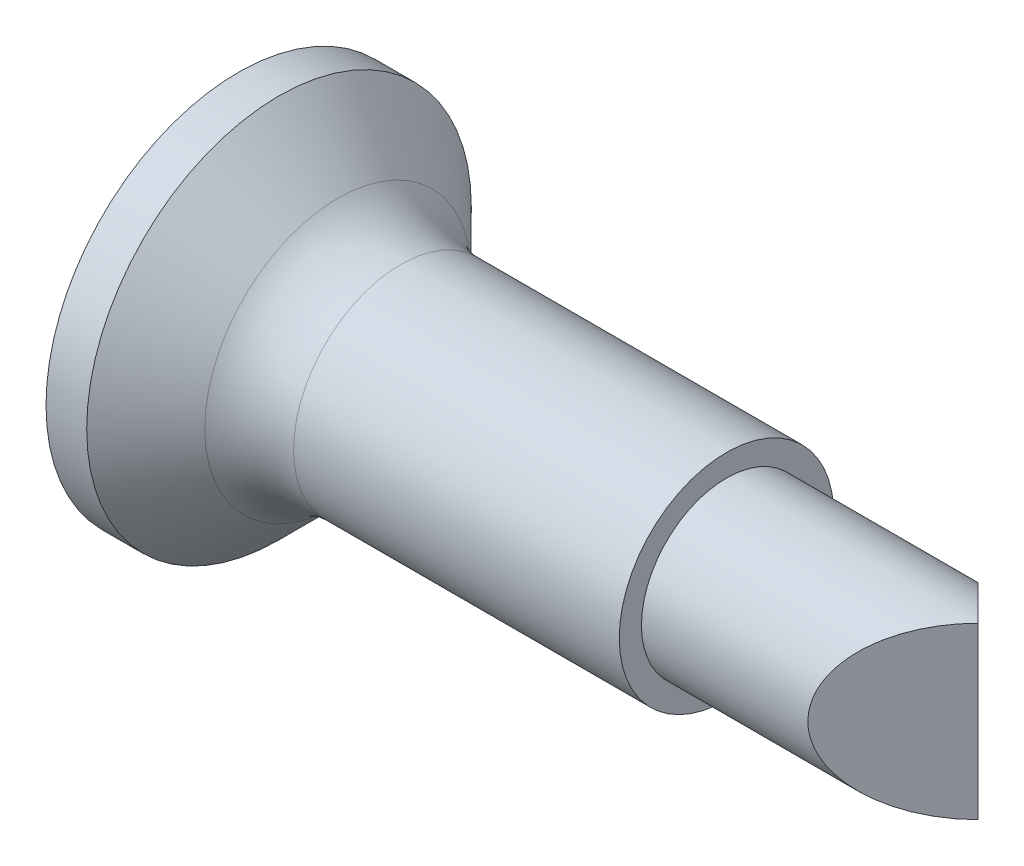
SolidWorks part; units mm, degrees
ref_plane "Front" through (0, 0, 0) normal (0, 0, 1) x (1, 0, 0)
ref_plane "Top" through (0, 0, 0) normal (0, 1, 0) x (1, 0, 0)
ref_plane "Right" through (0, 0, 0) normal (1, 0, 0) x (0, 0, -1)
sketch "Sketch1" plane through (0, 0, 0) normal (0, 0, 1) x (1, 0, 0)
  line L0 (-68.7142, 0) -> (93.1333, 0) construction
  line L1 (0.7, 2.6) -> (1.25, 2.6)
  line L2 (1.25, 2.6) -> (2.4, 1.45)
  line L3 (2.4, 1.45) -> (7.3, 1.45)
  line L4 (7.3, 1.45) -> (7.3, 1.15)
  line L5 (7.3, 1.15) -> (10.7, 1.15)
  line L6 (10.7, 1.15) -> (10.7, 0)
  line L7 (10.7, 0) -> (0, 0)
  line L8 (2.95, 2.6) -> (2.95, 0.6853) construction
  arc A0 (0.7, 2.6) -> (0, 0) centre (5.1786, 0) ccw
  dimension "d" = 2.9
  dimension "dp" = 2.3
  dimension "D4" = 45
  dimension "dk" = 5.2
  dimension "k" = 1.7
  dimension "f" = 0.7
  dimension "l" = 10
  dimension "lg" = 6.6
  dimension "a" = 1.1
revolve "Base" add sketch "Sketch1" angle 360 about L0
sketch "Sketch2" plane through (0, 0, 0) normal (0, 1, 0) x (1, 0, 0)
  line L0 (11.3362, 0) -> (14.3992, 0) construction
  line L2 (10.7, 0) -> (-4.3, 15)
  line L3 (-4.3, 15) -> (11.0466, 15)
  line L4 (11.0466, 15) -> (11.0466, -15)
  line L6 (-4.3, -15) -> (11.0466, -15)
  line L7 (10.7, 0) -> (-4.3, -15)
  line L8 (10.7, -1.15) -> (10.7, 1.15) construction
  point P11 (11.0466, 0)
  dimension "D1" = 45
  dimension "D2" = 15
  dimension "D3" = 0.3466
extrude "Cut-Extrude1" cut sketch "Sketch2" against normal through all and the other way through all
sketch "Sketch3" plane through (0, 0, 0) normal (1, 0, 0) x (0, 0, -1)
  line L0 (3.0091, 0) -> (-3.0547, 0) construction
  line L1 (0, -3.1383) -> (0, 3.1839) construction
  line L2 (-0.34, 0.34) -> (-1.7, 0.34)
  line L3 (0.34, -1.7) -> (-0.34, -1.7)
  line L4 (0.34, -1.7) -> (0.34, -0.34)
  line L5 (0.34, 1.7) -> (-0.34, 1.7)
  line L6 (-0.34, -1.7) -> (-0.34, -0.34)
  line L7 (1.7, 0.34) -> (0.34, 0.34)
  line L8 (1.7, 0.34) -> (1.7, -0.34)
  line L9 (1.7, -0.34) -> (0.34, -0.34)
  line L10 (-1.7, 0.34) -> (-1.7, -0.34)
  line L11 (-0.34, 0.34) -> (-0.34, 1.7)
  line L12 (-0.34, -0.34) -> (-1.7, -0.34)
  line L13 (0.34, 0.34) -> (0.34, 1.7)
  dimension "m" = 3.4
  dimension "D2" = 3.4
  dimension "D3" = 0.68
  dimension "D4" = 0.68
extrude "CrossRecess" cut sketch "Sketch3" along normal blind 0.85
fillet "Fillet1" radius 1.2 1 edges at (2.4, 0, 1.45)
fillet "Fillet2" radius 0.34 4 edges at (0.4362, -0.34, -0.34) (0.4362, -0.34, 0.34) (0.4362, 0.34, 0.34) (0.4362, 0.34, -0.34)
draft "Draft1" type of draft neutral plane draft angle 25 neutral plane "Right" faces to draft 4 parameters "D1"=25
sketch "Sketch4" plane through (0, 0, 0) normal (1, 0, 0) x (0, 0, -1)
  line L0 (-3.0851, 0) -> (3.2219, 0) construction
  line L1 (0, -3.0623) -> (0, 2.9255) construction
  line L2 (0, 0) -> (2.482, 2.482) construction
  line L3 (0, 0) -> (-2.6424, 2.6424) construction
  line L4 (0, 0.5081) -> (1.2021, 1.2021)
  line L5 (1.2021, 1.2021) -> (0.5081, 0)
  line L6 (0, 0.5081) -> (-1.2021, 1.2021)
  line L7 (-1.2021, 1.2021) -> (-0.5081, 0)
  line L8 (-1.2021, -1.2021) -> (-0.5081, 0)
  line L9 (0, -0.5081) -> (-1.2021, -1.2021)
  line L10 (1.2021, -1.2021) -> (0.5081, 0)
  line L11 (0, -0.5081) -> (1.2021, -1.2021)
  dimension "D1" = 45
  dimension "D2" = 15
  dimension "D3" = 3.4
extrude "Cut-Extrude4" [suppressed] cut sketch "Sketch4" along normal blind 0.85
sketch "Sketch5" plane through (0, 0, 0) normal (0, 0, 1) x (1, 0, 0)
  line L0 (0, 0) -> (11.146, 0) construction
  line L1 (3.3268, 1.7964) -> (3.6732, 1.7964)
  line L2 (3.6732, 1.7964) -> (3.6732, 1.45)
  line L3 (3.6732, 1.45) -> (3.5, 1.15)
  line L4 (3.5, 1.15) -> (3.3268, 1.45)
  line L5 (3.3268, 1.45) -> (3.3268, 1.7964)
  line L6 (0.7, 2.6) -> (0.7, -2.6) construction
  dimension "D1" = 2.9
  dimension "D2" = 2.3
  dimension "D3" = 2.8
revolve "Cut-Revolve10" [suppressed] cut sketch "Sketch5" angle 360 about L0
pattern_linear "LPattern10" [suppressed] count 9 spacing 0.45 along (1, 0, 0)
equation "\"D1@ThreadCosmetic1\" = \"lg@Sketch1\" - \"k@Sketch1\""
equation "\"D2@ThreadCosmetic1\" = \"dp@Sketch1\""
equation "\"D2@Sketch3\" = \"m@Sketch3\""
equation "\"D3@Sketch3\" = \"D4@Sketch3\""
equation "\"D4@Sketch3\" = \"m@Sketch3\" / 5"
equation "\"D1@Fillet2\" = \"D3@Sketch3\" / 2"
equation "\"D3@Sketch4\" = \"m@Sketch3\""
equation "\"D1@Cut-Extrude4\" = \"D1@CrossRecess\""
equation "\"D1@CrossRecess\" = \"k@Sketch1\" / 2"
equation "\"D1@Sketch5\" = \"d@Sketch1\""
equation "\"D2@Sketch5\" = \"dp@Sketch1\""
equation "\"D3@Sketch5\" =\"a@Sketch1\" + \"k@Sketch1\""
equation "\"D3@LPattern10\" =( \"d@Sketch1\" - \"dp@Sketch1\") / 2*1.5"
equation "\"D1@LPattern10\" =(\"lg@Sketch1\" - \"k@Sketch1\" - \"a@Sketch1\") / \"D3@LPattern10\"+1"
